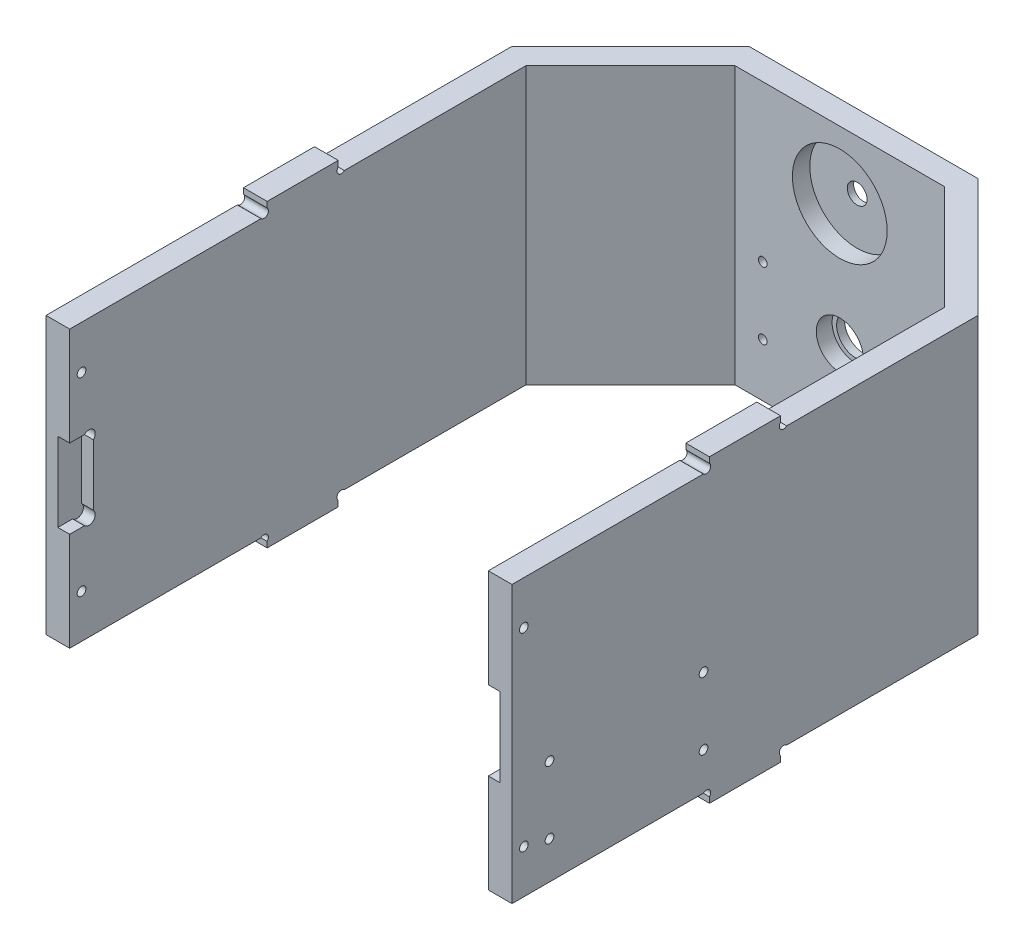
SolidWorks part; units mm, degrees
ref_plane "Plan de face" through (0, 0, 0) normal (0, 0, 1) x (1, 0, 0)
ref_plane "Plan de dessus" through (0, 0, 0) normal (0, 1, 0) x (1, 0, 0)
ref_plane "Plan de droite" through (0, 0, 0) normal (1, 0, 0) x (0, 0, -1)
sketch "Esquisse1" plane through (0, 0, 0) normal (0, 1, 0) x (1, 0, 0)
  line L0 (0, 101.301) -> (0, -77.0945) construction
  line L1 (-59, 59) -> (-29, 89)
  line L2 (-59, 59) -> (-59, -59)
  line L3 (-59, -59) -> (-53, -59)
  line L4 (59, 59) -> (59, -59)
  line L5 (-59, 97.3844) -> (-59, -88.3668) construction
  line L6 (-93.3959, 59) -> (76.844, 59) construction
  line L7 (76.844, 0) -> (-81.2306, 0) construction
  line L8 (-53, 56.5147) -> (-53, -53) construction
  line L9 (-81.2306, 34) -> (-54.0627, 34) construction
  line L10 (53, -59) -> (53, 56.5147)
  line L11 (59, 97.3844) -> (59, -88.3668) construction
  line L12 (-93.3959, -59) -> (76.844, -59) construction
  line L13 (-59, 59) -> (-6.7976, 111.2024) construction
  line L14 (-93.3959, 89) -> (65.2474, 89) construction
  line L15 (59, 59) -> (29, 89)
  line L16 (-29, 89) -> (29, 89)
  line L17 (53, 56.5147) -> (26.5147, 83)
  line L18 (53, -53) -> (-53, -53) construction
  line L19 (26.5147, 83) -> (-26.5147, 83) construction
  line L20 (-53, 56.5147) -> (-26.5147, 83) construction
  line L21 (53, 56.5147) -> (53, -53) construction
  line L22 (53, 56.5147) -> (26.5147, 83) construction
  line L23 (26.5147, 83) -> (-26.5147, 83)
  line L24 (-26.5147, 83) -> (-53, 56.5147)
  line L25 (-53, 56.5147) -> (-53, -59)
  line L26 (53, -59) -> (59, -59)
  circle A1 centre (0, 0) radius 46.5 construction
  point P42 (0, 0)
  dimension "D1" = 6
  dimension "D2" = 59
  dimension "D11" = 6
  dimension "D3" = 6
  dimension "D4" = 59
  dimension "D5" = 118
  dimension "D6" = 25
  dimension "D9" = 45
  dimension "D10" = 30
  dimension "D13" = 6
extrude "Boss.-Extru.1" add sketch "Esquisse1" along normal blind 76
sketch "Esquisse3" plane through (0, 0, -83) normal (0, 0, 1) x (1, 0, 0)
  line L0 (0, -3.372) -> (0, 77.6907) construction
  line L1 (-17.8349, 25) -> (4.2464, 25) construction
  line L2 (-26.5147, 0) -> (26.5147, 0) construction
  line L3 (24.0389, 16.5) -> (9.1828, 16.5) construction
  line L4 (-22.5, 36.5) -> (22.5, 36.5) construction
  line L5 (-22.5, 36.5) -> (-22.5, 13.5) construction
  line L6 (-22.5, 13.5) -> (22.5, 13.5) construction
  line L7 (22.5, 36.5) -> (22.5, 13.5) construction
  line L8 (-22.5, 36.5) -> (22.5, 13.5) construction
  line L9 (-22.5, 13.5) -> (22.5, 36.5) construction
  line L10 (19.5, 9.9597) -> (19.5, 28.3448) construction
  line L11 (-26.5147, 76) -> (26.5147, 76) construction
  circle A0 centre (0, 25) radius 4.8
  circle A1 centre (19.5, 16.5) radius 1.1
  circle A2 centre (19.5, 33.5) radius 1.1
  circle A3 centre (-19.5, 16.5) radius 1.1
  circle A4 centre (-19.5, 33.5) radius 1.1
  circle A5 centre (0, 56) radius 2.5
  dimension "D2" = 3
  dimension "D4" = 20
  dimension "D1" = 25
  dimension "D3" = 3
extrude "Enlèv. mat.-Extru.1" cut sketch "Esquisse3" against normal blind 6
sketch "Esquisse4" plane through (0, 0, -83) normal (0, 0, 1) x (1, 0, 0)
  circle A0 centre (0, 25) radius 5.95
extrude "Enlèv. mat.-Extru.2" cut sketch "Esquisse4" against normal blind 4
ref_plane "Plan1" through (0, 0, 0) normal (1, 0, 0) x (0, 0, -1)
sketch "Esquisse6" plane through (0, 0, 0) normal (1, 0, 0) x (0, 0, -1)
  line L0 (-96.5523, 38) -> (-35.3812, 38) construction
  line L1 (-53, -13.511) -> (-53, 57.6854) construction
  line L2 (-89.7555, 48) -> (-47.1057, 48) construction
  line L3 (-53, 48) -> (-67.4307, 33.5693) construction
  line L4 (-59, 76) -> (-59, 0) construction
  line L5 (-55.2627, 28) -> (-59, 28)
  line L6 (-53, 30.2627) -> (-53, 45.7373)
  line L7 (-55.2627, 48) -> (-59, 48)
  line L8 (-59, 48) -> (-59, 28)
  arc A0 (-53, 45.7373) -> (-55.2627, 48) centre (-54.1314, 46.8686) ccw
  arc A1 (-53, 30.2627) -> (-55.2627, 28) centre (-54.1314, 29.1314) cw
  dimension "D1" = 10
  dimension "D2" = 45
  dimension "D3" = 6
extrude "Enlèv. mat.-Extru.3" cut sketch "Esquisse6" against normal mid plane 112
sketch "Esquisse7" plane through (0, 0, 0) normal (1, 0, 0) x (0, 0, -1)
  line L0 (-56, 86.6836) -> (-56, 46.2171) construction
  line L1 (-59, 38) -> (-80.4816, 38) construction
  line L2 (-59, 48) -> (-59, 28) construction
  line L3 (-59, 76) -> (-59, 48) construction
  line L4 (-74.0371, 62) -> (-53.9528, 62) construction
  circle A0 centre (-56, 62) radius 1.1
  circle A1 centre (-56, 14) radius 1.1
  dimension "D1" = 3
extrude "Enlèv. mat.-Extru.4" cut sketch "Esquisse7" against normal mid plane 118
sketch "Esquisse8" plane through (-59, 0, 0) normal (-1, 0, 0) x (0, 0, 1)
  line L0 (70.5772, 73) -> (-65.8723, 73) construction
  line L1 (59, 38) -> (90.5081, 38) construction
  line L2 (59, 76) -> (59, 0) construction
  line L3 (0, -21.8167) -> (0, 103.3259) construction
  line L4 (9, 103.3259) -> (9, 70.3634) construction
  line L5 (-59, 76) -> (59, 76) construction
  line L6 (9, 73) -> (25.7518, 89.7518) construction
  line L7 (9, 74.5556) -> (9, 76)
  line L8 (10.5556, 73) -> (59, 73)
  line L9 (9, 76) -> (59, 76)
  line L10 (59, 76) -> (59, 73)
  line L11 (-9, 74.5556) -> (-9, 76)
  line L12 (-9, 76) -> (-89, 76)
  line L13 (-89, 76) -> (-89, 73)
  line L14 (-89, 76) -> (-89, 0) construction
  line L15 (-89, 73) -> (-10.5556, 73)
  line L16 (59, 0) -> (59, 3)
  line L17 (9, 0) -> (59, 0)
  line L18 (10.5556, 3) -> (59, 3)
  line L19 (9, 1.4444) -> (9, 0)
  line L20 (-89, 3) -> (-10.5556, 3)
  line L21 (-89, 0) -> (-89, 3)
  line L22 (-9, 0) -> (-89, 0)
  line L23 (-9, 1.4444) -> (-9, 0)
  arc A0 (9, 74.5556) -> (10.5556, 73) centre (9.7778, 73.7778) ccw
  arc A1 (-9, 74.5556) -> (-10.5556, 73) centre (-9.7778, 73.7778) cw
  arc A2 (9, 1.4444) -> (10.5556, 3) centre (9.7778, 2.2222) cw
  arc A3 (-9, 1.4444) -> (-10.5556, 3) centre (-9.7778, 2.2222) ccw
  dimension "D1" = 3
  dimension "D2" = 9
  dimension "D3" = 45
extrude "Enlèv. mat.-Extru.5" cut sketch "Esquisse8" against normal through all
sketch "Esquisse9" plane through (0, 0, -83) normal (0, 0, 1) x (1, 0, 0)
  circle A0 centre (0, 56) radius 12
extrude "Enlèv. mat.-Extru.6" cut sketch "Esquisse9" against normal blind 4.4
sketch "Esquisse10" plane through (53, 0, 0) normal (-1, 0, 0) x (0, 0, 1)
  line L0 (53, 30.2627) -> (53, -5.1757) construction
  line L1 (72.6518, 3) -> (-19.7488, 3) construction
  line L2 (-10.5556, 3) -> (-59, 3) construction
  line L3 (72.8495, 21) -> (-10.3579, 21) construction
  line L4 (30, 32.9123) -> (30, -25.5222) construction
  line L5 (10.5, 6.9578) -> (10.5, 19.189) construction
  line L6 (7.5, 32.5) -> (52.5, 32.5) construction
  line L7 (7.5, 32.5) -> (7.5, 9.5) construction
  line L8 (7.5, 9.5) -> (52.5, 9.5) construction
  line L9 (52.5, 32.5) -> (52.5, 9.5) construction
  line L10 (7.5, 32.5) -> (52.5, 9.5) construction
  line L11 (7.5, 9.5) -> (52.5, 32.5) construction
  line L12 (5.8848, 12.5) -> (24.7082, 12.5) construction
  circle A0 centre (10.5, 12.5) radius 1.1
  circle A1 centre (49.5, 12.5) radius 1.1
  circle A2 centre (49.5, 29.5) radius 1.1
  circle A3 centre (10.5, 29.5) radius 1.1
  point P11 (30, 21)
  dimension "D1" = 18
  dimension "D2" = 0.5
  dimension "D3" = 3
  dimension "D4" = 3
extrude "Enlèv. mat.-Extru.7" cut sketch "Esquisse10" against normal blind 6
